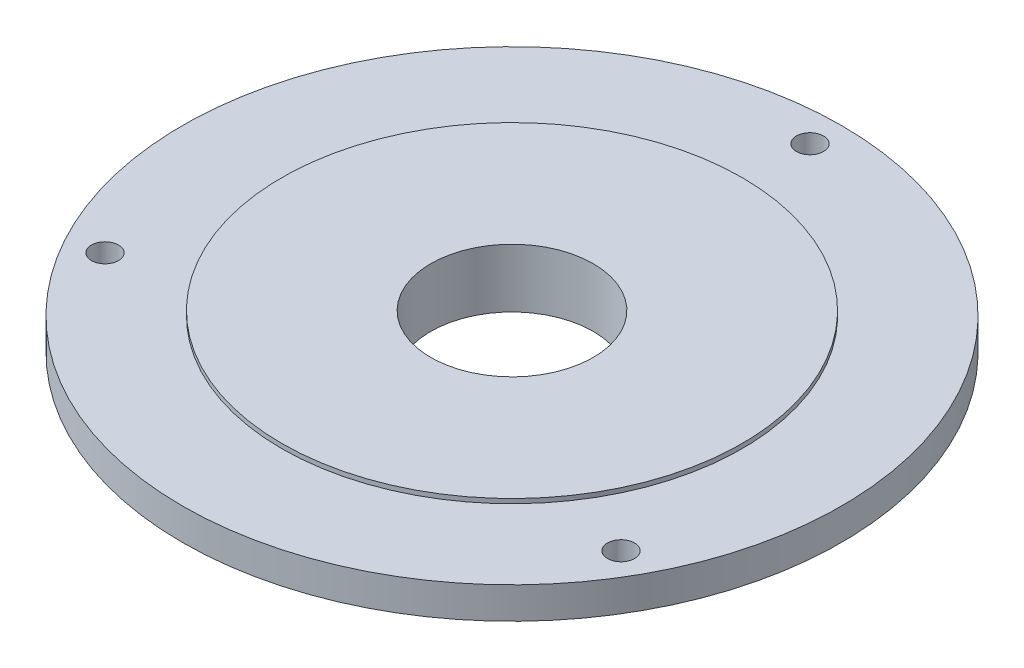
SolidWorks part; units mm, degrees
ref_plane "Piano frontale" through (0, 0, 0) normal (0, 0, 1) x (1, 0, 0)
ref_plane "Piano superiore" through (0, 0, 0) normal (0, 1, 0) x (1, 0, 0)
ref_plane "Piano destro" through (0, 0, 0) normal (1, 0, 0) x (0, 0, -1)
sketch "Schizzo1" plane through (0, 0, 0) normal (0, 0, 1) x (1, 0, 0)
  line L0 (0, 0) -> (0, 68.8521) construction
  line L4 (36.5, 37.8859) -> (36.5, 34.3859)
  line L10 (14.25, 34.3859) -> (36.5, 34.3859)
  line L15 (9, 38.3859) -> (25.5, 38.3859)
  line L16 (25.5, 38.3859) -> (25.5, 37.8859)
  line L17 (9, 31.8859) -> (9, 38.3859)
  line L18 (25.5, 37.8859) -> (36.5, 37.8859)
  line L19 (9, 31.8859) -> (14.25, 31.8859)
  line L20 (14.25, 31.8859) -> (14.25, 34.3859)
  dimension "D1" = 25.5
  dimension "D2" = 36.5
  dimension "D3" = 2.5
  dimension "D4" = 0.5
  dimension "D5" = 9
  dimension "D6" = 3.5
  dimension "D7" = 14.25
revolve "Rivoluzione1" add sketch "Schizzo1" angle 360 about L0
sketch "Schizzo2" plane through (0, 37.8859, 0) normal (0, 1, 0) x (1, 0, 0)
  circle A0 centre (0, 33) radius 1.5
  circle A1 centre (28.5788, -16.5) radius 1.5
  circle A2 centre (-28.5788, -16.5) radius 1.5
  point P10 (0, 0)
  dimension "D1" = 3
  dimension "D2" = 33
  dimension "D3" = 3
extrude "Taglio-Estrusione1" cut sketch "Schizzo2" against normal through all
